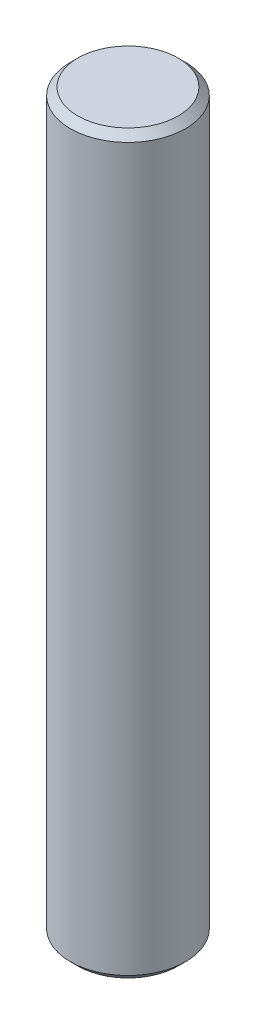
SolidWorks part; units mm, degrees
ref_plane "Front Plane" through (0, 0, 0) normal (0, 0, 1) x (1, 0, 0)
ref_plane "Top Plane" through (0, 0, 0) normal (0, 1, 0) x (1, 0, 0)
ref_plane "Right Plane" through (0, 0, 0) normal (1, 0, 0) x (0, 0, -1)
sketch "Sketch1" plane through (0, 0, 0) normal (0, 1, 0) x (1, 0, 0)
  circle A0 centre (0, 0) radius 3.9713
  dimension "D1" = 7.9426
extrude "Extrude1" add sketch "Sketch1" along normal mid plane 50.8
chamfer "Chamfer1" distance 0.508 angle 45 2 edges at (0, -25.4, 3.9713) (0, 25.4, 3.9713)
